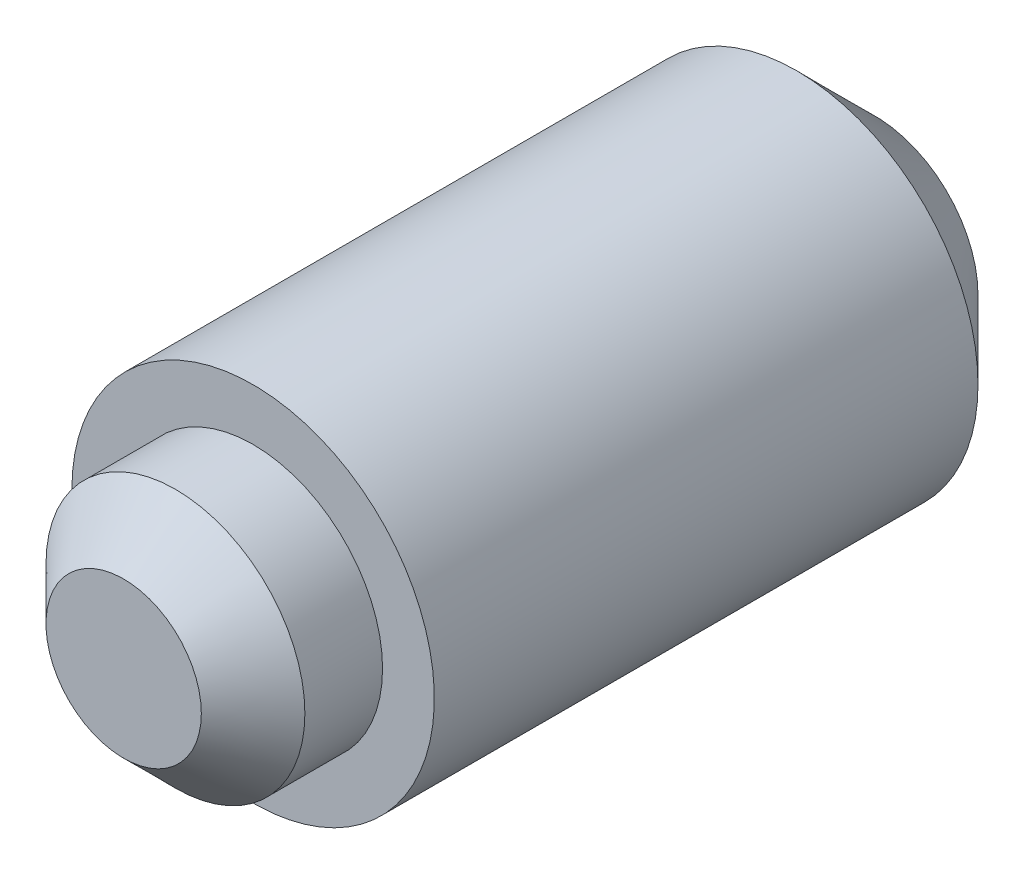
SolidWorks part; units mm, degrees
ref_plane "Přední" through (0, 0, 0) normal (0, 0, 1) x (1, 0, 0)
ref_plane "Horní" through (0, 0, 0) normal (0, 1, 0) x (1, 0, 0)
ref_plane "Pravá" through (0, 0, 0) normal (1, 0, 0) x (0, 0, -1)
sketch "Skica1" plane through (0, 0, 0) normal (0, 0, 1) x (1, 0, 0)
  circle A0 centre (0, 0) radius 7
  dimension "D1" = 14
extrude "Vysunout1" add sketch "Skica1" along normal mid plane 29
sketch "Skica2" plane through (0, 0, 14.5) normal (0, 0, 1) x (1, 0, 0)
  circle A0 centre (0, 0) radius 5
  dimension "D1" = 10
extrude "Odebrat vysunutím1" cut sketch "Skica2" against normal blind 5 flip side to cut
chamfer "Zkosit1" distance 3 angle 45 1 edges at (7, 0, -14.5)
chamfer "Zkosit2" distance 2 angle 45 1 edges at (5, 0, 14.5)
